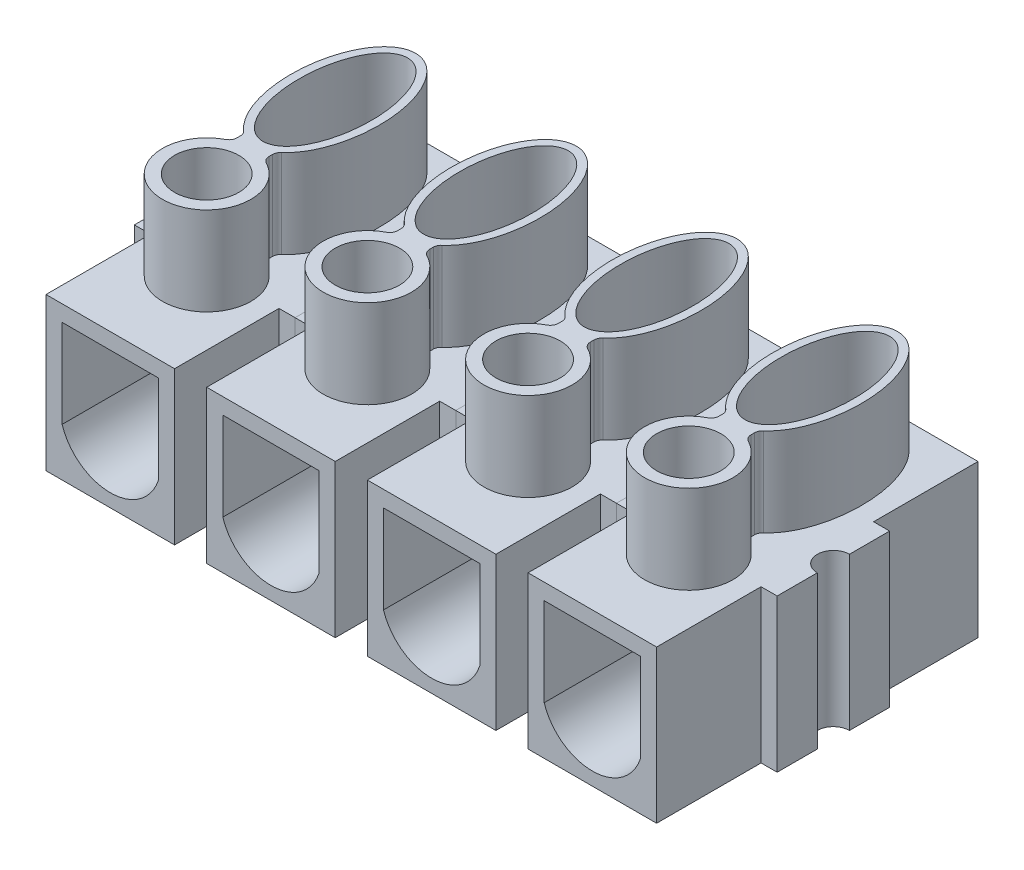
SolidWorks part; units mm, degrees
ref_plane "Plan1" through (0, 0, 0) normal (0, 0, 1) x (1, 0, 0)
ref_plane "Plan2" through (0, 0, 0) normal (0, 1, 0) x (1, 0, 0)
ref_plane "Plan3" through (0, 0, 0) normal (1, 0, 0) x (0, 0, -1)
sketch "Esquisse1" plane through (0, 0, 0) normal (0, 0, 1) x (1, 0, 0)
  line L0 (-2.9974, -1) -> (3, -1)
  line L1 (-4, 0) -> (4, 0)
  line L2 (-4, 0) -> (-4, -9.5)
  line L3 (-4, -9.5) -> (4, -9.5)
  line L4 (4, 0) -> (4, -9.5)
  line L5 (3, -1) -> (3, -6.5)
  line L6 (-2.9974, -1) -> (-2.9974, -6.5)
  arc A0 (-2.9974, -6.5) -> (3, -6.5) centre (0.0013, -5.5355) ccw
  dimension "D8" = 3.15
  dimension "D1" = 8
  dimension "D2" = 9.5
  dimension "D3" = 1
  dimension "D4" = 1
  dimension "D5" = 1.0026
  dimension "D6" = 5.5
  dimension "D7" = 5.5
extrude "Extrusion1" add sketch "Esquisse1" along normal mid plane 20
sketch "Esquisse2" plane through (4, 0, 0) normal (1, 0, 0) x (0, 0, -1)
  line L0 (-10, 0) -> (10, 0) construction
  line L1 (-3.5, 0) -> (3.5, 0)
  line L2 (-3.5, 0) -> (-3.5, -9.5)
  line L3 (-3.5, -9.5) -> (3.5, -9.5)
  line L4 (3.5, 0) -> (3.5, -9.5)
  line L5 (-10, -9.5) -> (10, -9.5) construction
  dimension "D1" = 7
extrude "Extrusion2" add sketch "Esquisse2" along normal blind 1
mirror "Symétrie1" about plane through (0, 0, 0) normal (1, 0, 0) of "Extrusion2"
sketch "Esquisse3" plane through (0, 0, 0) normal (0, 1, 0) x (-1, 0, 0)
  line L0 (-5, -3.5) -> (-5, 3.5) construction
  line L1 (-5, 1) -> (-5, -1)
  line L2 (0, -5.2114) -> (0, 4.8181) construction
  line L3 (5, 1) -> (5, -1)
  arc A0 (-5, -1) -> (-5, 1) centre (-5, 0) ccw
  arc A1 (5, -1) -> (5, 1) centre (5, 0) cw
  dimension "D1" = 1
extrude "Enlèv. mat.-Extru.1" cut sketch "Esquisse3" against normal through all
sketch "Esquisse4" plane through (0, 0, 0) normal (0, 1, 0) x (-1, 0, 0)
  circle A0 centre (0, 4) radius 2
  circle A1 centre (0, -4) radius 2
  dimension "D1" = 4
  dimension "D2" = 4
  dimension "D3" = 4
  dimension "D4" = 4
extrude "Enlèv. mat.-Extru.2" cut sketch "Esquisse4" against normal blind 3
sketch "Esquisse5" plane through (0, 0, 0) normal (0, 1, 0) x (-1, 0, 0)
  circle A0 centre (0, 4) radius 2
  circle A1 centre (0, 4) radius 2 construction
  circle A2 centre (0, 4) radius 2.75
  dimension "D1" = 5.5
extrude "Extrusion3" add sketch "Esquisse5" along normal blind 5.5
sketch "Esquisse6" plane through (0, 0, 0) normal (0, 1, 0) x (-1, 0, 0)
  ellipse E0 centre (0, -4) end of major axis (0, -9) minor radius 2.75
  ellipse E1 centre (0, -4) end of major axis (0, -8.5) minor radius 2.25
  dimension "D3" = 4.5
  dimension "D1" = 5.5
  dimension "D2" = 10
  dimension "D4" = 9
extrude "Extrusion4" add sketch "Esquisse6" along normal blind 5.5
sketch "Esquisse7" plane through (0, 0, 0) normal (0, 0, 1) x (1, 0, 0)
  line L0 (2.75, 5.5) -> (-2.75, 5.5) construction
  line L1 (-1, 5.5) -> (1, 5.5)
  line L2 (-1, 5.5) -> (-1, 0)
  line L3 (-1, 0) -> (1, 0)
  line L4 (1, 5.5) -> (1, 0)
  line L5 (4, 0) -> (-4, 0) construction
  dimension "D1" = 2
extrude "Extrusion5" add sketch "Esquisse7" along normal blind 1 from offset 0.5
fillet "Congé1" radius 0.5 6 edges at (0, 0, -9) (0, 5.5, -9) (1, 2.75, 0.6577) (-1, 2.75, 0.6577) (-1, 2.75, 1.4383) (1, 2.75, 1.4383)
pattern_linear "Répétition linéaire3" count 4 spacing 10 along (1, 0, 0)
